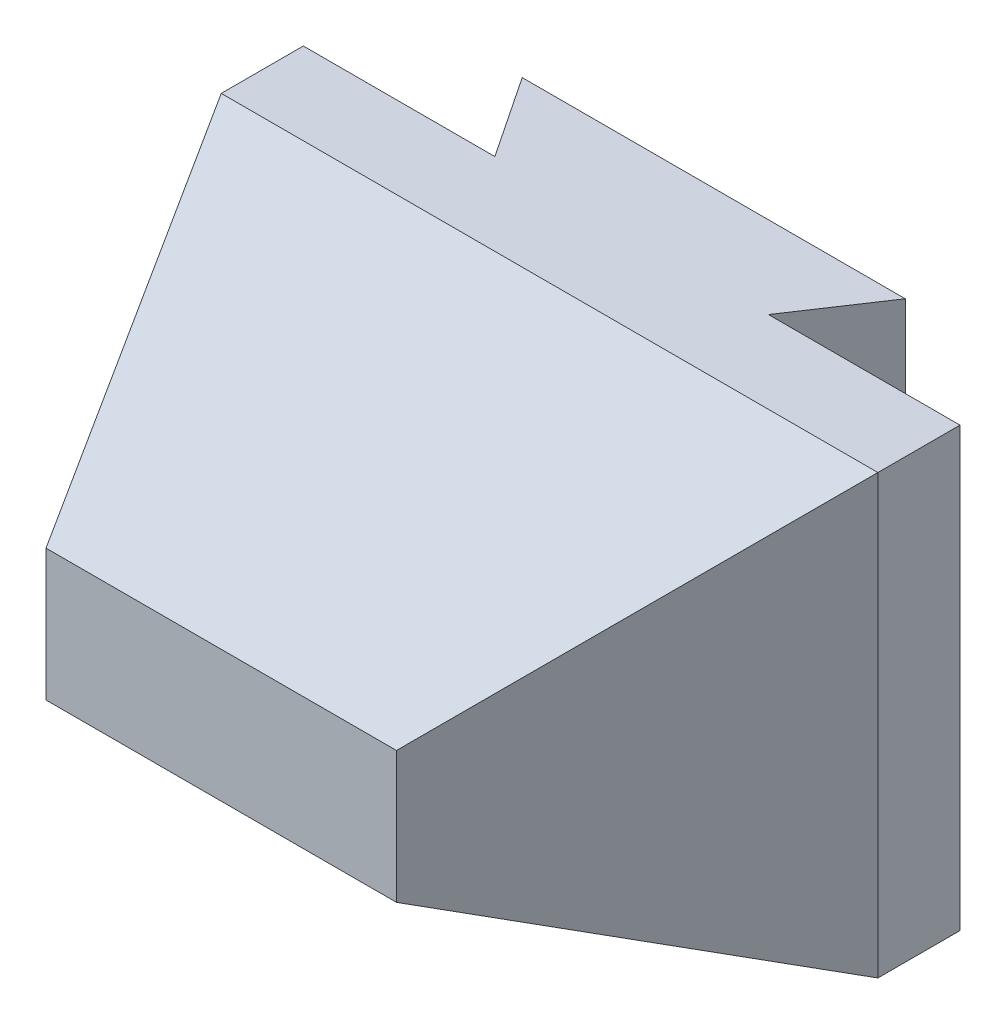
SolidWorks part; units mm, degrees
ref_plane "前视基准面" through (0, 0, 0) normal (0, 0, 1) x (1, 0, 0)
ref_plane "上视基准面" through (0, 0, 0) normal (0, 1, 0) x (1, 0, 0)
ref_plane "右视基准面" through (0, 0, 0) normal (1, 0, 0) x (0, 0, -1)
sketch "草图1" plane through (0, 0, 0) normal (0, 0, 1) x (1, 0, 0)
  line L0 (-100.3592, 0) -> (98.7534, 0) construction
  line L1 (0, -59.8141) -> (0, 60.2155) construction
  line L3 (-60, 40) -> (60, 40)
  line L4 (-60, 40) -> (-60, -40)
  line L5 (-60, -40) -> (60, -40)
  line L6 (60, 40) -> (60, -40)
  dimension "D1" = 120
  dimension "D2" = 80
extrude "拉伸1" add sketch "草图1" along normal blind 60 draft 25
sketch "草图2" plane through (0, 0, 0) normal (0, 0, -1) x (-1, 0, 0)
  line L4 (60, -40) -> (60, 40)
  line L5 (60, 40) -> (-60, 40)
  line L6 (-60, 40) -> (-60, -40)
  line L7 (-60, -40) -> (60, -40)
  line L8 (60, -40) -> (60, 40)
  line L9 (60, 40) -> (-60, 40)
  line L10 (-60, 40) -> (-60, -40)
  line L11 (-60, -40) -> (60, -40)
  dimension "D1" = 0
extrude "拉伸2" add sketch "草图2" along normal blind 30
sketch "草图3" plane through (0, 40, 0) normal (0, 1, 0) x (1, 0, 0)
  line L0 (-60, 15) -> (-25, 15)
  line L1 (-60, 30) -> (-60, 0) construction
  line L2 (-25, 15) -> (-35, 30)
  line L3 (60, 30) -> (-60, 30) construction
  line L4 (-35, 30) -> (-60, 30)
  line L5 (-60, 30) -> (-60, 15)
  dimension "D1" = 35
  dimension "D2" = 25
extrude "切除-拉伸1" cut sketch "草图3" against normal through all
mirror "镜向1" about plane through (0, 0, 0) normal (1, 0, 0) of "切除-拉伸1"
